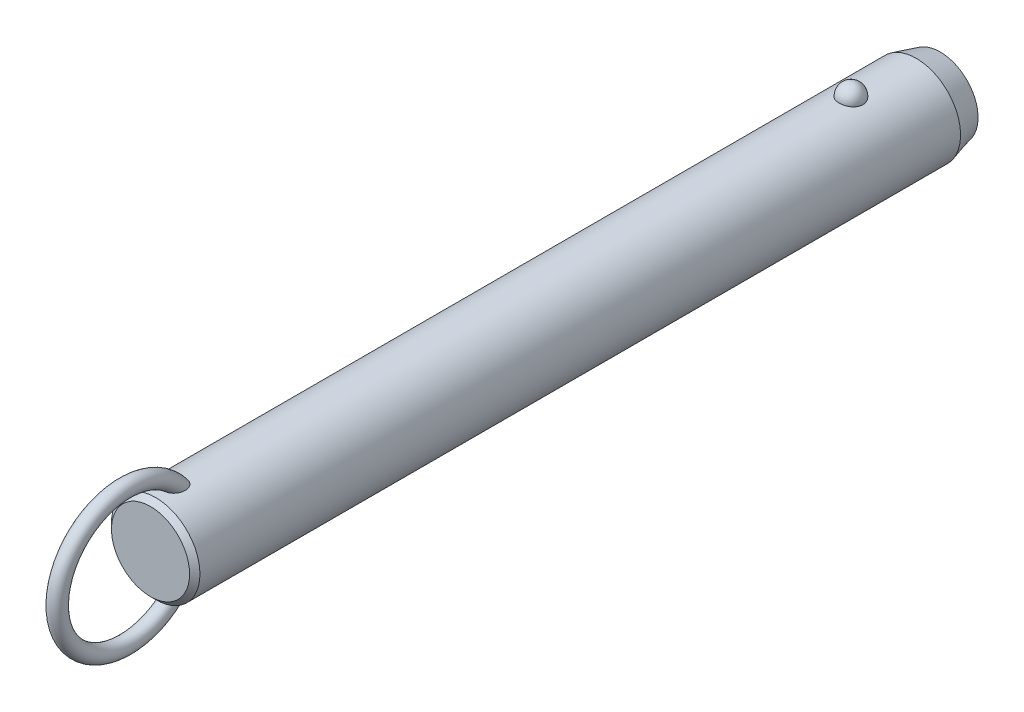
SolidWorks part; units mm, degrees
ref_plane "Front Plane" through (0, 0, 0) normal (0, 0, 1) x (1, 0, 0)
ref_plane "Top Plane" through (0, 0, 0) normal (0, 1, 0) x (1, 0, 0)
ref_plane "Right Plane" through (0, 0, 0) normal (1, 0, 0) x (0, 0, -1)
sketch "Sketch2" plane through (0, 0, 0) normal (0, 0, 1) x (1, 0, 0)
  circle A0 centre (0, 0) radius 11.1
  point P3 (0, 11.1)
  dimension "D1" = 22.2
extrude "Boss-Extrude1" add sketch "Sketch2" along normal blind 160
sketch "Sketch3" plane through (0, 0, 0) normal (0, 0, -1) x (-1, 0, 0)
  circle A0 centre (0, 0) radius 11.1
  dimension "D1" = 22.2
extrude "Boss-Extrude2" add sketch "Sketch3" along normal blind 25.4
chamfer "Chamfer1" distance 6 angle 15 1 edges at (-11.1, 0, -25.4)
sketch "Sketch12" plane through (0, 0, 0) normal (1, 0, 0) x (0, 0, -1)
  line L0 (-160, 11.1) -> (-160, -11.1) construction
  point P0 (-160, 0)
sketch "Sketch13" plane through (0, 0, 0) normal (1, 0, 0) x (0, 0, -1)
  circle A0 centre (-179.05, 0) radius 19.05
  point P2 (-160, 0)
  dimension "D1" = 38.1
sketch "Sketch14" plane through (0, 0, 0) normal (0, 1, 0) x (1, 0, 0)
  circle A0 centre (0, -162) radius 2
  point P2 (0, -160)
  dimension "D1" = 4
sweep "Sweep1" add profiles "Sketch14" path "Sketch13"
sketch "Sketch15" plane through (0, 0, 160) normal (0, 0, 1) x (1, 0, 0)
  circle A0 centre (0, 0) radius 11.1
  dimension "D1" = 22.2
extrude "Boss-Extrude3" add sketch "Sketch15" along normal blind 12.7
chamfer "Chamfer2" distance 1.3 angle 45 1 edges at (11.1, 0, 172.7)
sketch "Sketch18" plane through (0, 0, 0) normal (1, 0, 0) x (0, 0, -1)
  line L0 (19.4, 11.1) -> (-163.568, 11.1) construction
  line L1 (3, 14.1) -> (3, 8.1)
  line L2 (-163.568, -11.1) -> (19.4, -11.1) construction
  arc A0 (3, 14.1) -> (3, 8.1) centre (3, 11.1) ccw
  point P4 (0, 11.1)
  dimension "D1" = 25.2
revolve "Revolve1" add sketch "Sketch18" angle 360 about L1
